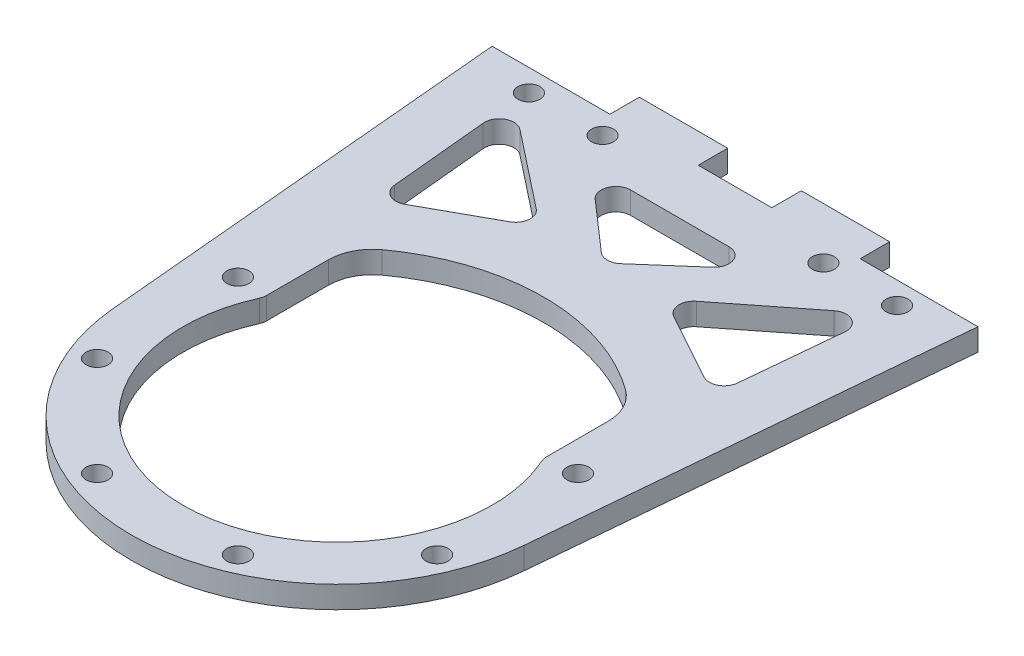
SolidWorks part; units mm, degrees
ref_plane "Front Plane" through (0, 0, 0) normal (0, 0, 1) x (1, 0, 0)
ref_plane "Top Plane" through (0, 0, 0) normal (0, 1, 0) x (1, 0, 0)
ref_plane "Right Plane" through (0, 0, 0) normal (1, 0, 0) x (0, 0, -1)
sketch "Sketch1" plane through (0, 0, 0) normal (0, 1, 0) x (1, 0, 0)
  circle A2 centre (0, 0) radius 28
  circle A3 centre (0, 0) radius 17.5 construction
  circle A4 centre (0, 0) radius 13.5
  circle A5 centre (0, 0) radius 21 construction
  circle A6 centre (0, -17.5) radius 1.5
  circle A7 centre (-17.5, 0) radius 1.5
  circle A8 centre (0, 17.5) radius 1.5
  circle A9 centre (17.5, 0) radius 1.5
  circle A10 centre (0, 0) radius 25 construction
  circle A11 centre (-9.5671, -23.097) radius 1.5
  circle A12 centre (-23.097, -9.5671) radius 1.5
  circle A13 centre (-23.097, 9.5671) radius 1.5
  circle A14 centre (-9.5671, 23.097) radius 1.5
  circle A15 centre (9.5671, 23.097) radius 1.5
  circle A16 centre (23.097, 9.5671) radius 1.5
  circle A17 centre (23.097, -9.5671) radius 1.5
  circle A18 centre (9.5671, -23.097) radius 1.5
  point P21 (0, 0)
  point P39 (0, 0)
  dimension "D2" = 27
  dimension "D4" = 35
  dimension "D5" = 42
  dimension "D6" = 3
  dimension "D8" = 50
  dimension "D9" = 3
  dimension "D3" = 56
  dimension "D7" = 4
  dimension "D10" = 8
extrude "Boss-Extrude1" add sketch "Sketch1" along normal blind 3
sketch "Sketch5" plane through (0, 0, 0) normal (0, -1, 0) x (1, 0, 0)
  circle A0 centre (0, 0) radius 21
  dimension "D1" = 42
extrude "Cut-Extrude4" cut sketch "Sketch5" against normal blind 10
sketch "Sketch6" plane through (0, 3, 0) normal (0, 1, 0) x (1, 0, 0)
  line L0 (0, 0) -> (0, 54) construction
  line L1 (-33, 54) -> (33, 54)
  line L2 (-33, 54) -> (-27.8861, -2.523)
  line L3 (33, 54) -> (27.8861, -2.523)
  circle A0 centre (0, 0) radius 28 construction
  circle A1 centre (0, 0) radius 28
  point P5 (0, 54)
  dimension "D1" = 54
  dimension "D2" = 66
extrude "Boss-Extrude2" add sketch "Sketch6" against normal through all contours A1 L0 L1 L2 | L0 L3 L1 M9
sketch "Sketch7" plane through (0, 3, 0) normal (0, 1, 0) x (1, 0, 0)
  line L0 (-33, 54) -> (33, 54) construction
  line L1 (-17, 54) -> (-5, 54)
  line L2 (-17, 54) -> (-17, 58)
  line L3 (-17, 58) -> (-5, 58)
  line L4 (-5, 54) -> (-5, 58)
  line L5 (17, 54) -> (5, 54)
  line L6 (17, 54) -> (17, 58)
  line L7 (17, 58) -> (5, 58)
  line L8 (5, 54) -> (5, 58)
  line L9 (-5, 58) -> (5, 58) construction
  point P12 (0, 54)
  point P13 (0, 58)
  dimension "D1" = 12
  dimension "D2" = 4
  dimension "D3" = 10
extrude "Boss-Extrude3" add sketch "Sketch7" against normal through all
sketch "Sketch9" plane through (0, 3, 0) normal (0, 1, 0) x (1, 0, 0)
  line L0 (-33, 54) -> (-17, 54) construction
  circle A0 centre (-25, 51) radius 1.5
  circle A1 centre (-15, 51) radius 1.5
  circle A2 centre (25, 51) radius 1.5
  circle A3 centre (15, 51) radius 1.5
  dimension "D5" = 3
  dimension "D1" = 8
  dimension "D2" = 8
  dimension "D3" = 10
  dimension "D4" = 10
  dimension "D6" = 3
extrude "Cut-Extrude6" cut sketch "Sketch9" against normal through all
sketch "Sketch10" [suppressed] plane through (0, 3, 0) normal (0, 1, 0) x (1, 0, 0)
  circle A0 centre (0, 0) radius 28 construction
  circle A1 centre (0, 0) radius 28
sketch "Sketch12" plane through (0, 3, 0) normal (0, 1, 0) x (1, 0, 0)
  circle A0 centre (9.5671, 23.097) radius 1.5 construction
  circle A1 centre (-9.5671, 23.097) radius 1.5 construction
  circle A2 centre (9.5671, 23.097) radius 1.5
  circle A3 centre (-9.5671, 23.097) radius 1.5
extrude "Boss-Extrude4" add sketch "Sketch12" against normal through all
sketch "Sketch11" plane through (0, 3, 0) normal (0, 1, 0) x (1, 0, 0)
  line L0 (-12, 46.5) -> (12, 46.5)
  line L1 (12, 46.5) -> (0, 36)
  line L2 (0, 36) -> (-12, 46.5)
  line L3 (-25, 49) -> (-8.5, 36)
  line L4 (-8.5, 36) -> (-23, 28)
  line L5 (-23, 28) -> (-25, 49)
  line L6 (25, 49) -> (23, 28)
  line L7 (23, 28) -> (8.5, 36)
  line L8 (8.5, 36) -> (25, 49)
  line L11 (-33, 54) -> (-17, 54) construction
  line L12 (-8.5, 36) -> (8.5, 36) construction
  line L13 (-23, 28) -> (23, 28) construction
  line L14 (17, 54) -> (33, 54) construction
  line L15 (19, 23.2164) -> (19, 8.9443)
  line L16 (0, -55) -> (0, 55) construction
  line L17 (-19, 23.2164) -> (-19, 8.9443)
  line L18 (-5, 54) -> (5, 54) construction
  circle A0 centre (0, 0) radius 21 construction
  circle A1 centre (0, 0) radius 28 construction
  circle A2 centre (0, 0) radius 28
  circle A3 centre (0, 0) radius 21
  circle A4 centre (0, 0) radius 30
  point P11 (25, 51)
  point P13 (0, 36)
  point P21 (0, 46.5)
  point P24 (0, 54)
  point P25 (0, 28)
  point P29 (-25, 51)
  dimension "D6" = 60
  dimension "D1" = 7.5
  dimension "D2" = 24
  dimension "D3" = 5
  dimension "D4" = 17
  dimension "D5" = 38
  dimension "D7" = 46
  dimension "D8" = 26
  dimension "D9" = 18
extrude "Cut-Extrude7" cut sketch "Sketch11" against normal through all
fillet "Fillet2" radius 2 11 edges at (0, 1.5, -36) (12, 1.5, -46.5) (8.5, 1.5, -36) (23, 1.5, -28) (25, 1.5, -49) (-23, 1.5, -28) (-8.5, 1.5, -36) (-25, 1.5, -49) (-12, 1.5, -46.5) (19, 1.5, -8.9443) (-19, 1.5, -8.9443)
fillet "Fillet3" radius 6 2 edges at (19, 1.5, -20.567) (-19, 1.5, -20.567)
